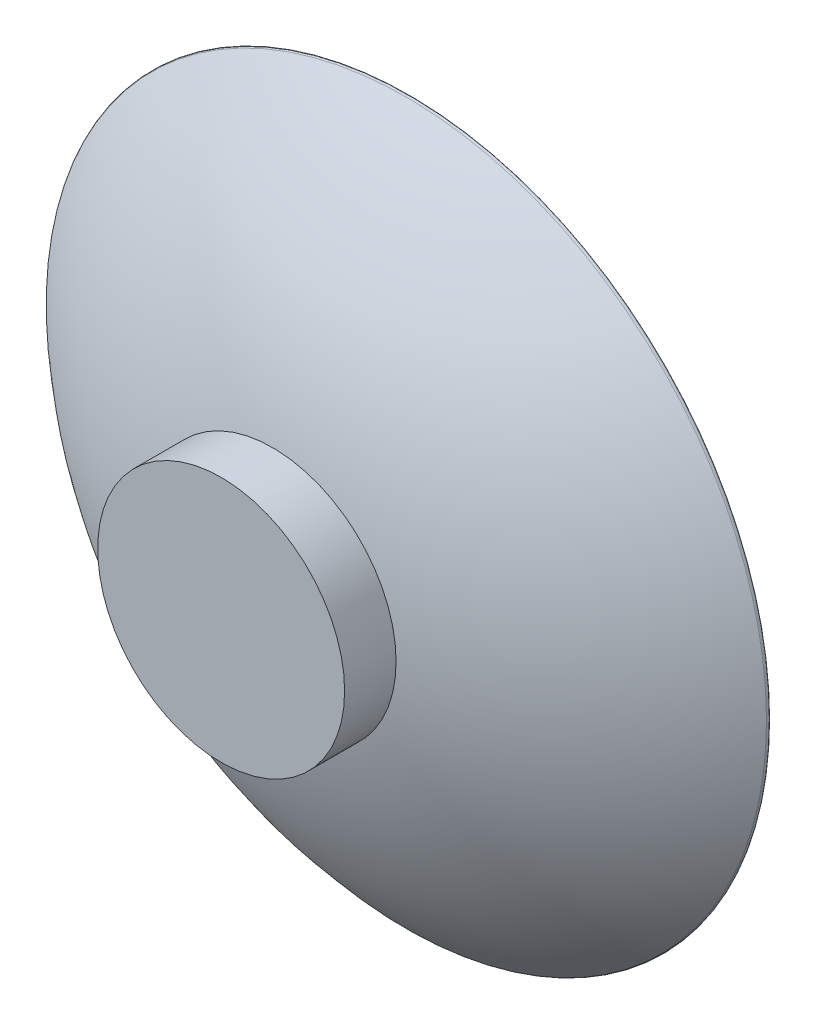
SolidWorks part; units mm, degrees
ref_plane "Alzado" through (0, 0, 0) normal (0, 0, 1) x (1, 0, 0)
ref_plane "Planta" through (0, 0, 0) normal (0, 1, 0) x (1, 0, 0)
ref_plane "Vista lateral" through (0, 0, 0) normal (1, 0, 0) x (0, 0, -1)
sketch "Croquis1" plane through (0, 0, 0) normal (0, 0, 1) x (1, 0, 0)
  circle A0 centre (0, 0) radius 60
  dimension "D1" = 120
extrude "Saliente-Extruir1" add sketch "Croquis1" along normal blind 25
sketch "Croquis3" plane through (0, 0, 0) normal (1, 0, 0) x (0, 0, -1)
  line L0 (0, 0) -> (65, 0) construction
  line L1 (65, 0) -> (65, 175) construction
  line L2 (0, 0) -> (1.9993, 0)
  line L3 (1.9993, 0) -> (1.9993, 0.054)
  line L4 (30.2443, 121.8632) -> (30.349, 122.0627)
  line L5 (13.976, 83.1657) -> (13.9066, 82.9514)
  line L6 (19.7276, 99.055) -> (19.6438, 98.8458)
  arc A0 (0, 0) -> (65, 175) centre (249.9089, 6.7481) cw
  arc A1 (1.9993, 0.054) -> (1.9142, 8.3733) centre (249.9089, 6.7481) cw
  arc A3 (65, 175) -> (66.4793, 173.654) centre (65.7396, 174.327) cw
  arc A4 (66.4793, 173.654) -> (63.8112, 170.6738) centre (65.1469, 172.1624) cw
  arc A5 (63.6623, 170.5047) -> (61.0454, 167.4795) centre (62.3556, 168.9906) cw
  arc A6 (60.8995, 167.3079) -> (58.3345, 164.2385) centre (59.6187, 165.7717) cw
  arc A7 (58.1914, 164.0644) -> (55.6791, 160.9518) centre (56.9371, 162.5067) cw
  arc A8 (55.5391, 160.7753) -> (53.0801, 157.6204) centre (54.3114, 159.1964) cw
  arc A9 (52.9432, 157.4415) -> (50.5383, 154.2451) centre (51.7426, 155.8419) cw
  arc A10 (50.4044, 154.0639) -> (48.0544, 150.8271) centre (49.2312, 152.4442) cw
  arc A11 (47.9235, 150.6436) -> (45.629, 147.3672) centre (46.7781, 149.0041) cw
  arc A12 (45.5013, 147.1815) -> (43.2629, 143.8665) centre (44.384, 145.5227) cw
  arc A13 (43.1384, 143.6787) -> (40.9568, 140.3259) centre (42.0495, 142.0011) cw
  arc A14 (40.8356, 140.1361) -> (38.7114, 136.7467) centre (39.7754, 138.4401) cw
  arc A15 (38.5934, 136.5547) -> (36.5273, 133.1296) centre (37.5623, 134.841) cw
  arc A16 (36.4126, 132.9357) -> (34.4051, 129.4759) centre (35.4108, 131.2047) cw
  arc A17 (34.2937, 129.2801) -> (32.3455, 125.7866) centre (33.3216, 127.5322) cw
  arc A18 (32.2374, 125.5889) -> (30.349, 122.0627) centre (31.2952, 123.8247) cw
  arc A19 (30.2443, 121.8632) -> (28.4163, 118.3054) centre (29.3323, 120.0832) cw
  arc A20 (28.315, 118.1041) -> (26.5478, 114.5156) centre (27.4335, 116.3088) cw
  arc A21 (26.45, 114.3126) -> (24.7442, 110.6946) centre (25.5992, 112.5026) cw
  arc A22 (24.6499, 110.49) -> (23.006, 106.8434) centre (23.83, 108.6657) cw
  arc A23 (22.9151, 106.6372) -> (21.3336, 102.9631) centre (22.1265, 104.7993) cw
  arc A24 (21.2463, 102.7554) -> (19.7276, 99.055) centre (20.489, 100.9043) cw
  arc A25 (19.6438, 98.8458) -> (18.1884, 95.12) centre (18.9182, 96.9821) cw
  arc A26 (18.1082, 94.9094) -> (16.7164, 91.1593) centre (17.4144, 93.0336) cw
  arc A27 (16.6398, 90.9475) -> (15.3121, 87.1742) centre (15.9781, 89.0601) cw
  arc A28 (15.2392, 86.961) -> (13.976, 83.1657) centre (14.6097, 85.0627) cw
  arc A29 (13.9066, 82.9514) -> (12.7083, 79.1351) centre (13.3096, 81.0425) cw
  arc A30 (12.6426, 78.9195) -> (11.5095, 75.0834) centre (12.0782, 77.0008) cw
  arc A31 (11.4475, 74.8668) -> (10.3799, 71.0119) centre (10.9159, 72.9387) cw
  arc A32 (10.3216, 70.7943) -> (9.3198, 66.9217) centre (9.8229, 68.8574) cw
  arc A33 (9.2652, 66.7031) -> (8.3295, 62.8141) centre (8.7996, 64.7581) cw
  arc A34 (8.2787, 62.5946) -> (7.4094, 58.6902) centre (7.8462, 60.6419) cw
  arc A35 (7.3623, 58.4699) -> (6.5596, 54.5512) centre (6.9632, 56.5101) cw
  arc A36 (6.5163, 54.3301) -> (5.7805, 50.3984) centre (6.1507, 52.3638) cw
  arc A37 (5.741, 50.1765) -> (5.0723, 46.2328) centre (5.4089, 48.2043) cw
  arc A38 (5.0365, 46.0104) -> (4.4352, 42.0558) centre (4.7381, 44.0328) cw
  arc A39 (4.4032, 41.8328) -> (3.8692, 37.8686) centre (4.1385, 39.8504) cw
  arc A40 (3.8411, 37.6451) -> (3.3748, 33.6723) centre (3.6102, 35.6584) cw
  arc A41 (3.3504, 33.4483) -> (2.9518, 29.4682) centre (3.1534, 31.4581) cw
  arc A42 (2.9313, 29.2439) -> (2.6006, 25.2576) centre (2.7682, 27.2505) cw
  arc A43 (2.5839, 25.0329) -> (2.3211, 21.0415) centre (2.4548, 23.037) cw
  arc A44 (2.3083, 20.8165) -> (2.1136, 16.8213) centre (2.2132, 18.8188) cw
  arc A45 (2.1045, 16.5962) -> (1.9779, 12.5982) centre (2.0435, 14.5971) cw
  arc A46 (1.9727, 12.3729) -> (1.9142, 8.3733) centre (1.9457, 10.3731) cw
  arc A47 (63.6623, 170.5047) -> (63.8112, 170.6738) centre (249.9089, 6.7481) cw
  arc A48 (1.9993, 0.054) -> (66.4793, 173.654) centre (249.9089, 6.7481) cw construction
  arc A49 (60.8995, 167.3079) -> (61.0454, 167.4795) centre (249.9089, 6.7481) cw
  arc A50 (58.1914, 164.0644) -> (58.3345, 164.2385) centre (249.9089, 6.7481) cw
  arc A51 (55.5391, 160.7753) -> (55.6791, 160.9518) centre (249.9089, 6.7481) cw
  arc A52 (52.9432, 157.4415) -> (53.0801, 157.6204) centre (249.9089, 6.7481) cw
  arc A53 (50.4044, 154.0639) -> (50.5383, 154.2451) centre (249.9089, 6.7481) cw
  arc A54 (47.9235, 150.6436) -> (48.0544, 150.8271) centre (249.9089, 6.7481) cw
  arc A55 (45.5013, 147.1815) -> (45.629, 147.3672) centre (249.9089, 6.7481) cw
  arc A56 (43.1384, 143.6787) -> (43.2629, 143.8665) centre (249.9089, 6.7481) cw
  arc A57 (40.8356, 140.1361) -> (40.9568, 140.3259) centre (249.9089, 6.7481) cw
  arc A58 (38.5934, 136.5547) -> (38.7114, 136.7467) centre (249.9089, 6.7481) cw
  arc A59 (36.4126, 132.9357) -> (36.5273, 133.1296) centre (249.9089, 6.7481) cw
  arc A60 (34.2937, 129.2801) -> (34.4051, 129.4759) centre (249.9089, 6.7481) cw
  arc A61 (32.2374, 125.5889) -> (32.3455, 125.7866) centre (249.9089, 6.7481) cw
  arc A62 (28.315, 118.1041) -> (28.4163, 118.3054) centre (249.9089, 6.7481) cw
  arc A63 (26.45, 114.3126) -> (26.5478, 114.5156) centre (249.9089, 6.7481) cw
  arc A64 (24.6499, 110.49) -> (24.7442, 110.6946) centre (249.9089, 6.7481) cw
  arc A65 (22.9151, 106.6372) -> (23.006, 106.8434) centre (249.9089, 6.7481) cw
  arc A66 (21.2463, 102.7554) -> (21.3336, 102.9631) centre (249.9089, 6.7481) cw
  arc A67 (18.1082, 94.9094) -> (18.1884, 95.12) centre (249.9089, 6.7481) cw
  arc A68 (16.6398, 90.9475) -> (16.7164, 91.1593) centre (249.9089, 6.7481) cw
  arc A69 (15.2392, 86.961) -> (15.3121, 87.1742) centre (249.9089, 6.7481) cw
  arc A70 (12.6426, 78.9195) -> (12.7083, 79.1351) centre (249.9089, 6.7481) cw
  arc A71 (11.4475, 74.8668) -> (11.5095, 75.0834) centre (249.9089, 6.7481) cw
  arc A72 (10.3216, 70.7943) -> (10.3799, 71.0119) centre (249.9089, 6.7481) cw
  arc A73 (9.2652, 66.7031) -> (9.3198, 66.9217) centre (249.9089, 6.7481) cw
  arc A74 (8.2787, 62.5946) -> (8.3295, 62.8141) centre (249.9089, 6.7481) cw
  arc A75 (7.3623, 58.4699) -> (7.4094, 58.6902) centre (249.9089, 6.7481) cw
  arc A76 (6.5163, 54.3301) -> (6.5596, 54.5512) centre (249.9089, 6.7481) cw
  arc A77 (5.741, 50.1765) -> (5.7805, 50.3984) centre (249.9089, 6.7481) cw
  arc A78 (5.0365, 46.0104) -> (5.0723, 46.2328) centre (249.9089, 6.7481) cw
  arc A79 (4.4032, 41.8328) -> (4.4352, 42.0558) centre (249.9089, 6.7481) cw
  arc A80 (3.8411, 37.6451) -> (3.8692, 37.8686) centre (249.9089, 6.7481) cw
  arc A81 (3.3504, 33.4483) -> (3.3748, 33.6723) centre (249.9089, 6.7481) cw
  arc A82 (2.9313, 29.2439) -> (2.9518, 29.4682) centre (249.9089, 6.7481) cw
  arc A83 (2.5839, 25.0329) -> (2.6006, 25.2576) centre (249.9089, 6.7481) cw
  arc A84 (2.3083, 20.8165) -> (2.3211, 21.0415) centre (249.9089, 6.7481) cw
  arc A85 (2.1045, 16.5962) -> (2.1136, 16.8213) centre (249.9089, 6.7481) cw
  arc A86 (1.9727, 12.3729) -> (1.9779, 12.5982) centre (249.9089, 6.7481) cw
  point P140 (249.9089, 6.7481)
  dimension "D3" = 250
  dimension "D5" = 2
  dimension "D1" = 65
  dimension "D2" = 175
  dimension "D4" = 2
  dimension "D6" = 43
revolve "Revolución11" add sketch "Croquis3" angle 360 about L0
sketch "Croquis4" plane through (0, 0, 0) normal (1, 0, 0) x (0, 0, -1)
  line L0 (1.581, 0) -> (81.581, 0) construction
  line L1 (1.581, 0) -> (81.581, 0)
  arc A0 (1.581, 0) -> (81.581, 0) centre (41.581, 0.9212) cw
  point P4 (0, 0)
  point P5 (0, 0)
  point P6 (41.581, 0.9212)
  dimension "D1" = 80
revolve "Revolución12" add sketch "Croquis4" angle 360 about L0
